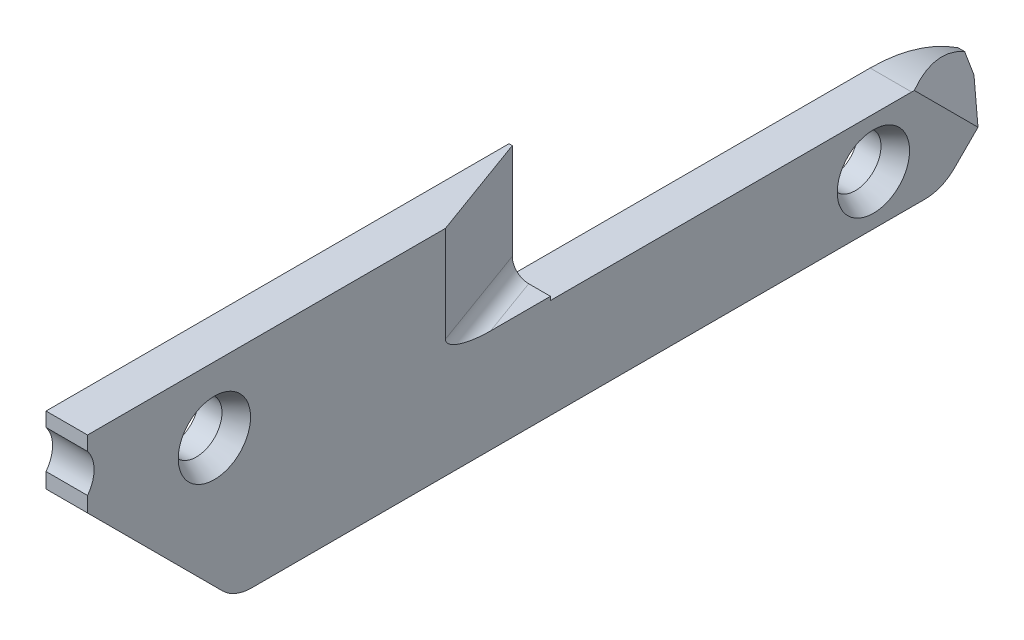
SolidWorks part; units mm, degrees
ref_plane "Спереди" through (0, 0, 0) normal (0, 0, 1) x (1, 0, 0)
ref_plane "Сверху" through (0, 0, 0) normal (0, 1, 0) x (1, 0, 0)
ref_plane "Справа" through (0, 0, 0) normal (1, 0, 0) x (0, 0, -1)
sketch "Эскиз1" plane through (0, 0, 0) normal (1, 0, 0) x (0, 0, -1)
  line L0 (53.7464, -3.7846) -> (25.908, -3.7846)
  line L1 (25.908, -3.7846) -> (25.908, 5.08)
  line L2 (25.908, 5.08) -> (-9.779, 5.08)
  line L3 (-9.779, 5.08) -> (-9.779, 3.9847)
  line L4 (-9.779, -0.127) -> (0.6195, -10.5255)
  line L5 (2.8645, -11.4554) -> (54.7878, -11.4554)
  line L6 (57.0329, -10.5255) -> (60.5282, -7.0301)
  line L7 (60.5282, -7.0301) -> (60.5282, -5.8244)
  line L8 (-9.779, 1.0445) -> (-9.779, -0.127)
  circle A0 centre (0, 0) radius 1.9812
  circle A1 centre (50.8, -7.62) radius 1.9812
  arc A2 (60.5282, -5.8244) -> (53.7464, -3.7846) centre (53.7464, -16.0782) ccw
  arc A3 (54.7878, -11.4554) -> (57.0329, -10.5255) centre (54.7878, -8.2804) ccw
  arc A4 (0.6195, -10.5255) -> (2.8645, -11.4554) centre (2.8645, -8.2804) ccw
  arc A5 (-9.779, 1.0445) -> (-9.779, 3.9847) centre (-11.6522, 2.5146) ccw
  point P22 (-9.271, 2.5146)
  dimension "D1" = 3.9624
  dimension "D5" = 3.175
  dimension "D12" = 12.2936
  dimension "D17" = 2.3813
  dimension "D2" = 7.62
  dimension "D3" = 50.8
  dimension "D4" = 7.6708
  dimension "D6" = 3.8354
  dimension "D7" = 16.5354
  dimension "D8" = 25.908
  dimension "D9" = 9.779
  dimension "D10" = 45
  dimension "D11" = 0.127
  dimension "D13" = 60.5282
  dimension "D14" = 54.7878
  dimension "D15" = 45
  dimension "D16" = 53.7464
  dimension "D18" = 0.508
  dimension "D19" = 13.97
extrude "Бобышка-Вытянуть1" add sketch "Эскиз1" along normal blind 3.2004
sketch "Эскиз2" plane through (0, -33.7792, -33.7792) normal (0, -0.7071, -0.7071) x (1, 0, 0)
  line L0 (3.2004, -35.4727) -> (0.508, -38.6814)
  line L1 (3.2004, -32.8857) -> (3.2004, -37.8288) construction
  line L2 (0.508, -38.6814) -> (3.2004, -38.6814)
  line L3 (3.2004, -38.6814) -> (3.2004, -35.4727)
  line L4 (3.2004, -38.6814) -> (0, -38.6814) construction
  line L5 (0, -32.8857) -> (0, -37.8288) construction
  dimension "D1" = 0.508
  dimension "D2" = 40
extrude "Вырез-Вытянуть1" cut sketch "Эскиз2" against normal through all
sketch "Эскиз3" plane through (0, 5.08, 0) normal (0, 1, 0) x (1, 0, 0)
  line L0 (3.2004, 17.8128) -> (3.2004, 25.908)
  line L1 (3.2004, 25.908) -> (3.2004, -9.779) construction
  line L2 (3.2004, 25.908) -> (0.254, 25.908)
  line L3 (3.2004, 25.908) -> (0, 25.908) construction
  line L4 (0.254, 25.908) -> (3.2004, 17.8128)
  line L5 (0, 25.908) -> (0, -9.779) construction
  dimension "D1" = 20
  dimension "D2" = 0.254
extrude "Вырез-Вытянуть2" cut sketch "Эскиз3" against normal offset from surface (8.5852 mm away) 7.9502
fillet "Скругление1" radius 1.1906 1 edges at (1.7272, -3.5052, -21.8604)
chamfer "Фаска1" distance 1.397 angle 30 2 edges at (3.2004, -7.62, -52.7812) (3.2004, 0, -1.9812)
